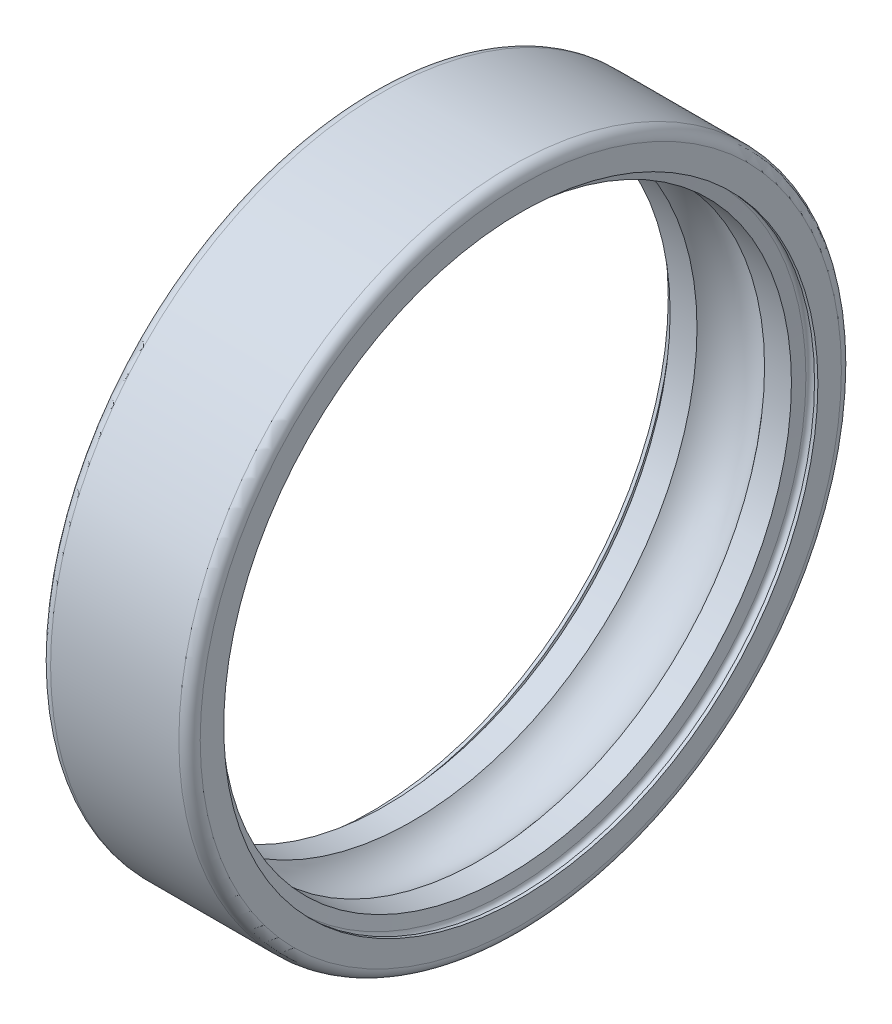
SolidWorks part; units mm, degrees
ref_plane "Plan de face" through (0, 0, 0) normal (0, 0, 1) x (1, 0, 0)
ref_plane "Plan de dessus" through (0, 0, 0) normal (0, 1, 0) x (1, 0, 0)
ref_plane "Plan de droite" through (0, 0, 0) normal (1, 0, 0) x (0, 0, -1)
ref_plane "Plan1" through (0, 0, 0) normal (0, 0, 1) x (1, 0, 0)
sketch "Esquisse1" plane through (0, 0, 0) normal (0, 0, 1) x (1, 0, 0)
  line L0 (0, 30) -> (0, 27.8)
  line L1 (0, 27.8) -> (0.3142, 27.8)
  line L2 (1.1222, 27.8) -> (1.325, 26.65)
  line L3 (1.325, 26.65) -> (3.8388, 26.65)
  line L4 (10.1612, 26.65) -> (12.675, 26.65)
  line L5 (12.675, 26.65) -> (12.8778, 27.8)
  line L6 (13.6858, 27.8) -> (14, 27.8)
  line L7 (14, 27.8) -> (14, 30)
  line L8 (13, 31) -> (1, 31)
  line L9 (13, 0) -> (1, 0) construction
  arc A0 (0.3142, 27.8) -> (1.1222, 27.8) centre (0.7182, 27.8) cw
  arc A1 (3.8388, 26.65) -> (10.1612, 26.65) centre (7, 24.25) cw
  arc A2 (12.8778, 27.8) -> (13.6858, 27.8) centre (13.2818, 27.8) cw
  arc A3 (14, 30) -> (13, 31) centre (13, 30) ccw
  arc A4 (1, 31) -> (0, 30) centre (1, 30) ccw
revolve "Révolution1" add sketch "Esquisse1" angle 360 about L9
